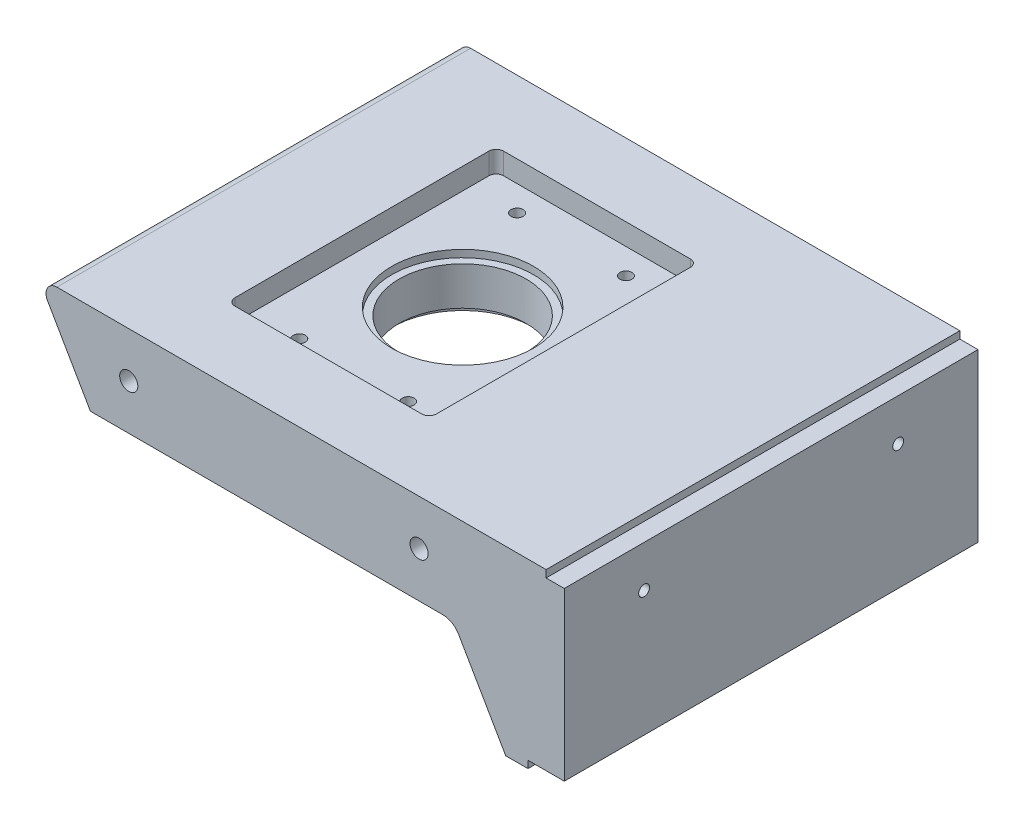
SolidWorks part; units mm, degrees
ref_plane "Front Plane" through (0, 0, 0) normal (0, 0, 1) x (1, 0, 0)
ref_plane "Top Plane" through (0, 0, 0) normal (0, 1, 0) x (1, 0, 0)
ref_plane "Right Plane" through (0, 0, 0) normal (1, 0, 0) x (0, 0, -1)
sketch "Sketch2" plane through (0, 0, 0) normal (0, 0, 1) x (1, 0, 0)
  line L0 (-60, 12.5) -> (80, 12.5)
  line L1 (85, -37.5) -> (85, 10.5)
  line L2 (80, 12.5) -> (80, 10.5)
  line L3 (0, 12.5) -> (0, -12.5) construction
  line L4 (80, 10.5) -> (85, 10.5)
  line L6 (85, -37.5) -> (68.87, -37.5)
  line L7 (68.87, -37.5) -> (54.4362, -12.5)
  line L8 (54.4362, -12.5) -> (-45.5662, -12.5)
  line L9 (-45.5662, -12.5) -> (-60, 12.5)
  dimension "D1" = 48
  dimension "D2" = 16.13
  dimension "D3" = 140
  dimension "D4" = 5
  dimension "D5" = 60
  dimension "D6" = 85
  dimension "D7" = 25
  dimension "D8" = 50
  dimension "D9" = 12.5
extrude "Boss-Extrude1" add sketch "Sketch2" along normal mid plane 114
sketch "Sketch5" plane through (0, 12.5, 0) normal (0, 1, 0) x (1, 0, 0)
  circle A0 centre (0, 0) radius 17.5
  dimension "D1" = 35
extrude "Cut-Extrude1" cut sketch "Sketch5" against normal through all
sketch "Sketch11" plane through (0, 0, 57) normal (0, 0, 1) x (1, 0, 0)
  line L0 (85, -37.5) -> (85, 10.5) construction
  line L1 (85, -35.5) -> (75, -35.5)
  line L2 (75, -35.5) -> (75, -37.5)
  line L3 (68.87, -37.5) -> (85, -37.5) construction
  line L4 (75, -37.5) -> (85, -37.5)
  line L5 (85, -37.5) -> (85, -35.5)
  dimension "D1" = 2
  dimension "D2" = 10
extrude "Cut-Extrude3" cut sketch "Sketch11" against normal through all
hole_wizard "M6x1.0 Tapped Hole1" positions "Sketch13" profile "Sketch12" tap size "M6x1.0" standard "ANSI Metric"
sketch "Sketch13" plane through (0, 0, 57) normal (0, 0, 1) x (1, 0, 0)
  line L0 (85, -35.5) -> (85, 10.5) construction
  line L1 (80, 12.5) -> (-60, 12.5) construction
  point P0 (-35, 0)
  point P2 (45, 0)
  dimension "D1" = 40
  dimension "D2" = 12.5
  dimension "D3" = 120
  dimension "D4" = 12.5
sketch "Sketch12" plane through (-35, 0, 57) normal (1, 0, 0) x (0, -1, 0)
  line L0 (0, 0) -> (0, 16.5022)
  line L1 (0, 16.5022) -> (2.5, 15)
  line L2 (2.5, 15) -> (2.5, 0)
  line L5 (2.5, 0) -> (0, 0)
  line L10 (0, 16.5022) -> (-2.5, 15) construction
  line L11 (0, -6.35) -> (0, 107.95) construction
  dimension "Tap Drill Dia." = 5
  dimension "Tap Drill Depth" = 15
  dimension "Drill Angle" = 118
mirror "Mirror1" about plane through (0, 0, 0) normal (0, 0, 1) of "M6x1.0 Tapped Hole1"
hole_wizard "M3x0.5 Tapped Hole2" positions "Sketch17" profile "Sketch16" tap size "M3x0.5" standard "ANSI Metric"
sketch "Sketch17" plane through (0, -35.5, 0) normal (0, -1, 0) x (-1, 0, 0)
  line L0 (-85, -57) -> (-75, -57) construction
  line L1 (-85, 57) -> (-75, 57) construction
  line L2 (-85, 57) -> (-85, -57) construction
  point P0 (-80, -37)
  point P2 (-80, 37)
  dimension "D1" = 20
  dimension "D2" = 20
  dimension "D3" = 5
  dimension "D4" = 5
sketch "Sketch16" plane through (80, -35.5, 37) normal (1, 0, 0) x (0, 0, -1)
  line L0 (0, 0) -> (0, 8.2511)
  line L1 (0, 8.2511) -> (1.25, 7.5)
  line L2 (1.25, 7.5) -> (1.25, 0)
  line L5 (1.25, 0) -> (0, 0)
  line L10 (0, 8.2511) -> (-1.25, 7.5) construction
  line L11 (0, -6.35) -> (0, 107.95) construction
  dimension "Tap Drill Dia." = 2.5
  dimension "Tap Drill Depth" = 7.5
  dimension "Drill Angle" = 118
hole_wizard "M5x0.8 Tapped Hole2" positions "Sketch21" profile "Sketch20" tap size "M5x0.8" standard "ANSI Metric"
sketch "Sketch21" plane through (0, 12.5, 0) normal (0, 1, 0) x (1, 0, 0)
  line L0 (80, 57) -> (-60, 57) construction
  point P0 (-20, 39)
  point P2 (20, 39)
  dimension "D1" = 18
  dimension "D2" = 18
  dimension "D3" = 20
  dimension "D4" = 20
sketch "Sketch20" plane through (-20, 12.5, -39) normal (1, 0, 0) x (0, 0, 1)
  line L0 (0, 0) -> (0, 13.6618)
  line L1 (0, 13.6618) -> (2.1, 12.4)
  line L2 (2.1, 12.4) -> (2.1, 0)
  line L5 (2.1, 0) -> (0, 0)
  line L10 (0, 13.6618) -> (-2.1, 12.4) construction
  line L11 (0, -6.35) -> (0, 107.95) construction
  dimension "Tap Drill Dia." = 4.2
  dimension "Tap Drill Depth" = 12.4
  dimension "Drill Angle" = 118
mirror "Mirror2" [suppressed] about plane through (0, 0, 0) normal (0, 0, 1)
sketch "Sketch22" [suppressed] plane through (0, 12.5, 0) normal (0, 1, 0) x (1, 0, 0)
  circle A0 centre (0, 0) radius 15
  dimension "D1" = 30
extrude "Cut-Extrude4" [suppressed] cut sketch "Sketch22" against normal blind 2
sketch "Sketch23" plane through (0, -12.5, 0) normal (0, -1, 0) x (1, 0, 0)
  circle A0 centre (0, 0) radius 19.55
  dimension "D1" = 39.1
extrude "Cut-Extrude5" [suppressed] cut sketch "Sketch23" against normal blind 2
fillet "Fillet1" radius 3 1 edges at (-60, 12.5, 0)
hole_wizard "M5x0.8 Tapped Hole3" positions "Sketch27" profile "Sketch26" tap size "M5x0.8" standard "ANSI Metric"
sketch "Sketch27" [suppressed] plane through (0, -12.5, 0) normal (0, -1, 0) x (-1, 0, 0)
  point P0 (20, -39)
  point P3 (-20, -39)
  point P6 (-20, 39)
  point P9 (20, 39)
sketch "Sketch26" plane through (-20, -12.5, 39) normal (1, 0, 0) x (0, 0, -1)
  line L0 (0, 0) -> (0, 13.6618)
  line L1 (0, 13.6618) -> (2.1, 12.4)
  line L2 (2.1, 12.4) -> (2.1, 0)
  line L5 (2.1, 0) -> (0, 0)
  line L10 (0, 13.6618) -> (-2.1, 12.4) construction
  line L11 (0, -6.35) -> (0, 107.95) construction
  dimension "Tap Drill Dia." = 4.2
  dimension "Tap Drill Depth" = 12.4
  dimension "Drill Angle" = 118
fillet "Fillet2" radius 5 1 edges at (54.4362, -12.5, 0)
sketch "Sketch28" plane through (0, 12.5, 0) normal (0, 1, 0) x (1, 0, 0)
  line L1 (-27.75, -37) -> (27.75, -37)
  line L2 (-27.75, -37) -> (-27.75, 37)
  line L3 (-27.75, 37) -> (27.75, 37)
  line L4 (27.75, -37) -> (27.75, 37)
  line L5 (-27.75, -37) -> (27.75, 37) construction
  line L6 (-27.75, 37) -> (27.75, -37) construction
  point P0 (0, 0)
  dimension "D1" = 55.5
  dimension "D2" = 74
extrude "Cut-Extrude6" cut sketch "Sketch28" against normal blind 5.9
sketch "Sketch30" plane through (0, 6.6, 0) normal (0, 1, 0) x (1, 0, 0)
  circle A0 centre (0, 0) radius 19.55
  dimension "D1" = 39.1
extrude "Cut-Extrude8" cut sketch "Sketch30" against normal blind 2
fillet "Fillet3" radius 2 4 edges at (27.75, 9.55, 37) (27.75, 9.55, -37) (-27.75, 9.55, 37) (-27.75, 9.55, -37)
hole_wizard "M4x0.7 Tapped Hole1" positions "Sketch34" profile "Sketch33" tap size "M4x0.7" standard "ANSI Metric"
sketch "Sketch34" plane through (0, 6.6, 0) normal (0, 1, 0) x (1, 0, 0)
  point P0 (15, 30)
  point P3 (-15, 30)
  point P6 (-15, -30)
  point P9 (15, -30)
sketch "Sketch33" plane through (15, 6.6, -30) normal (1, 0, 0) x (0, 0, 1)
  line L0 (0, 0) -> (0, 12.4914)
  line L1 (0, 12.4914) -> (1.65, 11.5)
  line L2 (1.65, 11.5) -> (1.65, 0)
  line L5 (1.65, 0) -> (0, 0)
  line L10 (0, 12.4914) -> (-1.65, 11.5) construction
  line L11 (0, -6.35) -> (0, 107.95) construction
  dimension "Tap Drill Dia." = 3.3
  dimension "Tap Drill Depth" = 11.5
  dimension "Drill Angle" = 118
sketch "Sketch35" plane through (0, -12.5, 0) normal (0, -1, 0) x (1, 0, 0)
  line L1 (-27.75, -47) -> (27.75, -47)
  line L2 (-27.75, -47) -> (-27.75, 47)
  line L3 (-27.75, 47) -> (27.75, 47)
  line L4 (27.75, -47) -> (27.75, 47)
  line L5 (-27.75, -47) -> (27.75, 47) construction
  line L6 (-27.75, 47) -> (27.75, -47) construction
  point P0 (0, 0)
  dimension "D1" = 94
  dimension "D2" = 55.5
extrude "Cut-Extrude11" cut sketch "Sketch35" against normal blind 4.5
fillet "Fillet6" radius 2 4 edges at (27.75, -10.25, 47) (27.75, -10.25, -47) (-27.75, -10.25, -47) (-27.75, -10.25, 47)
sketch "Sketch36" plane through (0, -8, 0) normal (0, -1, 0) x (1, 0, 0)
  circle A0 centre (0, 0) radius 19.55
  dimension "D1" = 39.1
extrude "Cut-Extrude12" cut sketch "Sketch36" against normal blind 2
hole_wizard "M4x0.7 Tapped Hole2" positions "Sketch38" profile "Sketch37" tap size "M4x0.7" standard "ANSI Metric"
sketch "Sketch38" plane through (0, -8, 0) normal (0, -1, 0) x (-1, 0, 0)
  point P0 (260.166, 40)
  point P3 (235.166, 40)
  point P6 (235.166, -40)
  point P9 (260.166, -40)
sketch "Sketch37" plane through (-260.166, -8, -40) normal (1, 0, 0) x (0, 0, -1)
  line L0 (0, 0) -> (0, 12.4914)
  line L1 (0, 12.4914) -> (1.65, 11.5)
  line L2 (1.65, 11.5) -> (1.65, 0)
  line L5 (1.65, 0) -> (0, 0)
  line L10 (0, 12.4914) -> (-1.65, 11.5) construction
  line L11 (0, -6.35) -> (0, 107.95) construction
  dimension "Tap Drill Dia." = 3.3
  dimension "Tap Drill Depth" = 11.5
  dimension "Drill Angle" = 118
hole_wizard "M4x0.7 Tapped Hole3" positions "Sketch42" profile "Sketch41" tap size "M4x0.7" standard "ANSI Metric"
sketch "Sketch42" plane through (0, -8, 0) normal (0, -1, 0) x (-1, 0, 0)
  point P0 (12.5, 40)
  point P3 (-12.5, 40)
  point P6 (-12.5, -40)
  point P9 (12.5, -40)
sketch "Sketch41" plane through (-12.5, -8, -40) normal (1, 0, 0) x (0, 0, -1)
  line L0 (0, 0) -> (0, 12.4914)
  line L1 (0, 12.4914) -> (1.65, 11.5)
  line L2 (1.65, 11.5) -> (1.65, 0)
  line L5 (1.65, 0) -> (0, 0)
  line L10 (0, 12.4914) -> (-1.65, 11.5) construction
  line L11 (0, -6.35) -> (0, 107.95) construction
  dimension "Tap Drill Dia." = 3.3
  dimension "Tap Drill Depth" = 11.5
  dimension "Drill Angle" = 118
hole_wizard "Ø3.0 (3) Diameter Hole2" positions "Sketch44" profile "Sketch43" hole size "Ø3.0" standard "ANSI Metric"
sketch "Sketch44" plane through (85, 0, 0) normal (1, 0, 0) x (0, 0, -1)
  line L0 (-39.1, -1) -> (-35, -1) construction
  line L1 (-35, -1) -> (-30.9, -1) construction
  line L3 (30.9, -1) -> (35, -1) construction
  line L4 (35, -1) -> (39.1, -1) construction
  arc A0 (-37.5, 0.6) -> (-37.5, -2.6) centre (-37.5, -1) ccw construction
  arc A1 (-32.5, -2.6) -> (-32.5, 0.6) centre (-32.5, -1) ccw construction
  arc A2 (32.5, 0.6) -> (32.5, -2.6) centre (32.5, -1) ccw construction
  arc A3 (37.5, -2.6) -> (37.5, 0.6) centre (37.5, -1) ccw construction
  point P0 (-35, -1)
  point P2 (35, -1)
sketch "Sketch43" plane through (85, -1, 35) normal (0, 1, 0) x (0, 0, -1)
  line L0 (0, 0) -> (0, 10.9013)
  line L1 (0, 10.9013) -> (1.5, 10)
  line L2 (1.5, 10) -> (1.5, 0)
  line L5 (1.5, 0) -> (0, 0)
  line L10 (0, 10.9013) -> (-1.5, 10) construction
  line L11 (0, -6.35) -> (0, 107.95) construction
  dimension "Hole Dia." = 3
  dimension "Hole Depth" = 10
  dimension "Drill Angle" = 118
